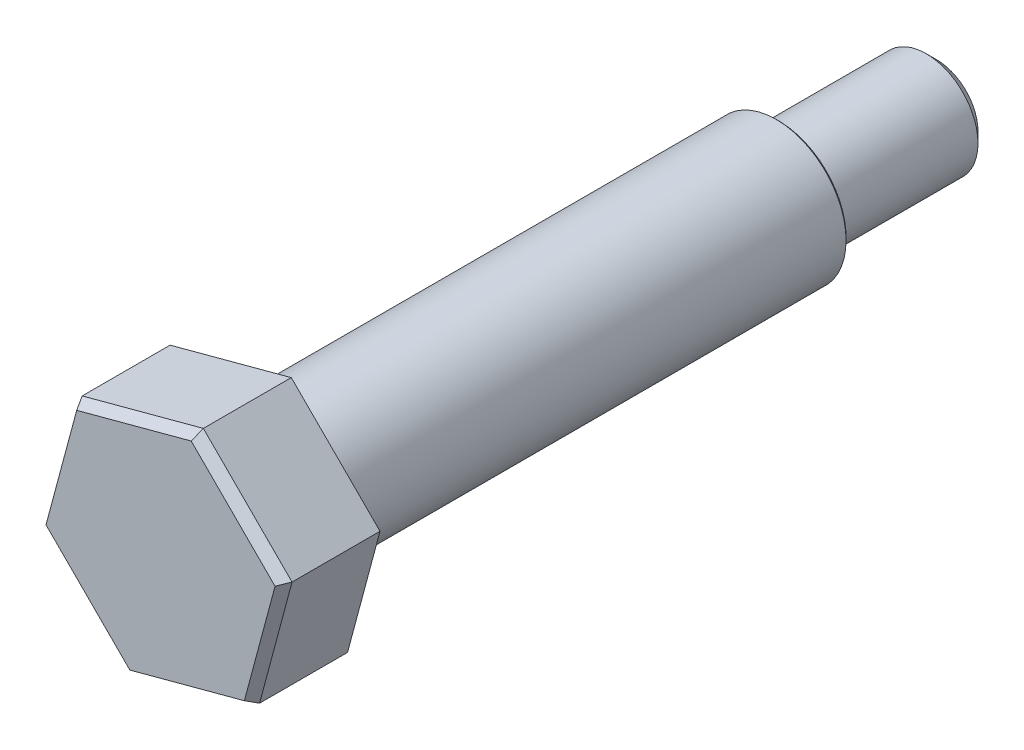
SolidWorks part; units mm, degrees
ref_plane "Plan1" through (0, 0, 0) normal (0, 0, 1) x (1, 0, 0)
ref_plane "Plan2" through (0, 0, 0) normal (0, 1, 0) x (1, 0, 0)
ref_plane "Plan3" through (0, 0, 0) normal (1, 0, 0) x (0, 0, -1)
sketch "Esquisse1" plane through (0, 0, 0) normal (0, 0, 1) x (1, 0, 0)
  circle A0 centre (0, 0) radius 13.4
  dimension "D1" = 26.8
extrude "Base-Extrusion" add sketch "Esquisse1" along normal blind 2
sketch "Esquisse2" plane through (0, 0, 2) normal (0, 0, 1) x (1, 0, 0)
  line L1 (17.1464, -17.1464) -> (23.4225, 6.276)
  line L2 (23.4225, 6.276) -> (6.276, 23.4225)
  line L3 (6.276, 23.4225) -> (-17.1464, 17.1464)
  line L4 (-17.1464, 17.1464) -> (-23.4225, -6.276)
  line L5 (-23.4225, -6.276) -> (-6.276, -23.4225)
  line L6 (-6.276, -23.4225) -> (17.1464, -17.1464)
  circle A0 centre (0, 0) radius 21 construction
  dimension "D1" = 42
extrude "Boss.-Extru.1" add sketch "Esquisse2" along normal blind 19
sketch "Esquisse3" plane through (0, 0, 0) normal (0, 0, -1) x (-1, 0, 0)
  circle A0 centre (0, 0) radius 13.5
  dimension "D1" = 27
extrude "Boss.-Extru.2" add sketch "Esquisse3" along normal blind 98.5
sketch "Esquisse4" plane through (0, 0, -98.5) normal (0, 0, -1) x (-1, 0, 0)
  circle A0 centre (0, 0) radius 10
  dimension "D1" = 20
extrude "Boss.-Extru.3" add sketch "Esquisse4" along normal blind 30.5
chamfer "Chanfrein1" distance 2 angle 45
chamfer "Chanfrein2" distance 0.5 angle 45
chamfer "Chanfrein3" distance 2 angle 30
fillet "Congé1" radius 0.5
